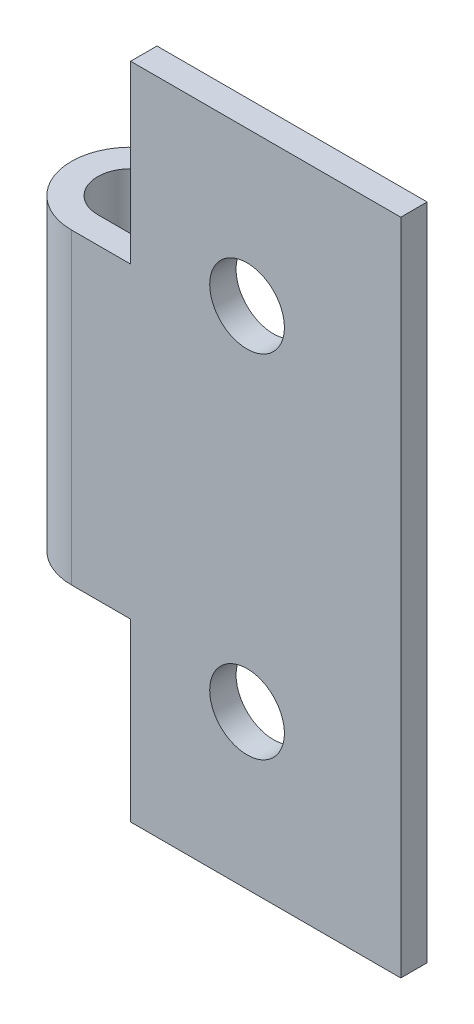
SolidWorks part; units mm, degrees
ref_plane "Ön Düzlem" through (0, 0, 0) normal (0, 0, 1) x (1, 0, 0)
ref_plane "Üst Düzlem" through (0, 0, 0) normal (0, 1, 0) x (1, 0, 0)
ref_plane "Sağ Düzlem" through (0, 0, 0) normal (1, 0, 0) x (0, 0, -1)
sketch "Çizim1" plane through (0, 0, 0) normal (0, 1, 0) x (1, 0, 0)
  line L0 (0, 7.8372) -> (0, -8.9997) construction
  line L1 (0, 0.6) -> (15, 0.6)
  line L3 (0, -0.6) -> (15, -0.6)
  line L4 (15, 0.6) -> (15, -0.6)
  line L5 (0, 0) -> (15, -0.6) construction
  line L6 (0, 0) -> (15, 0.6) construction
  line L7 (2.3018, 0.6888) -> (1.2788, 1.316)
  arc A0 (2.3018, 0.6888) -> (0, -0.6) centre (0, 2.1) ccw
  arc A4 (1.2788, 1.316) -> (0, 0.6) centre (0, 2.1) ccw
  point P0 (0, 0)
  dimension "D1" = 2.7
  dimension "D2" = 1.2
extrude "Yükseklik-Ekstrüzyon1" add sketch "Çizim1" against normal blind 30
sketch "Çizim3" plane through (0, -30, 0) normal (0, -1, 0) x (1, 0, 0)
  line L0 (1.2788, -1.316) -> (2.3018, -0.6888) construction
  line L1 (1.2788, -1.316) -> (2.3018, -0.6888)
  line L3 (0, -0.6) -> (2.7, -0.6)
  line L4 (2.7, -0.6) -> (2.7, 0.6)
  line L5 (0, 0.6) -> (15, 0.6) construction
  line L6 (15, -0.6) -> (0, -0.6) construction
  line L7 (0, 0.6) -> (2.7, 0.6)
  arc A0 (0, -0.6) -> (1.2788, -1.316) centre (0, -2.1) ccw construction
  arc A1 (0, 0.6) -> (2.3018, -0.6888) centre (0, -2.1) ccw construction
  arc A2 (0, -0.6) -> (1.2788, -1.316) centre (0, -2.1) ccw
  arc A3 (0, 0.6) -> (2.3018, -0.6888) centre (0, -2.1) ccw
extrude "Kes-Ekstrüzyon2" cut sketch "Çizim3" against normal blind 8
sketch "Çizim4" plane through (0, 0, -0.6) normal (0, 0, -1) x (-1, 0, 0)
  line L0 (0, -31.2224) -> (0, 1.1804) construction
  line L2 (-15, 0) -> (0, 0) construction
  circle A0 centre (-8, -23) radius 1.7
  circle A1 centre (-8, -7) radius 1.7
  dimension "D4" = 3.4
  dimension "D5" = 3.4
  dimension "D1" = 8
  dimension "D2" = 16
  dimension "D3" = 7
extrude "Kes-Ekstrüzyon3" cut sketch "Çizim4" against normal blind 1.2
ref_plane "Düzlem1" through (0, -15, 0) normal (0, -1, 0) x (-1, 0, 0)
mirror "Aynalama1" about plane through (0, -15, 0) normal (0, -1, 0) of "Kes-Ekstrüzyon2"
